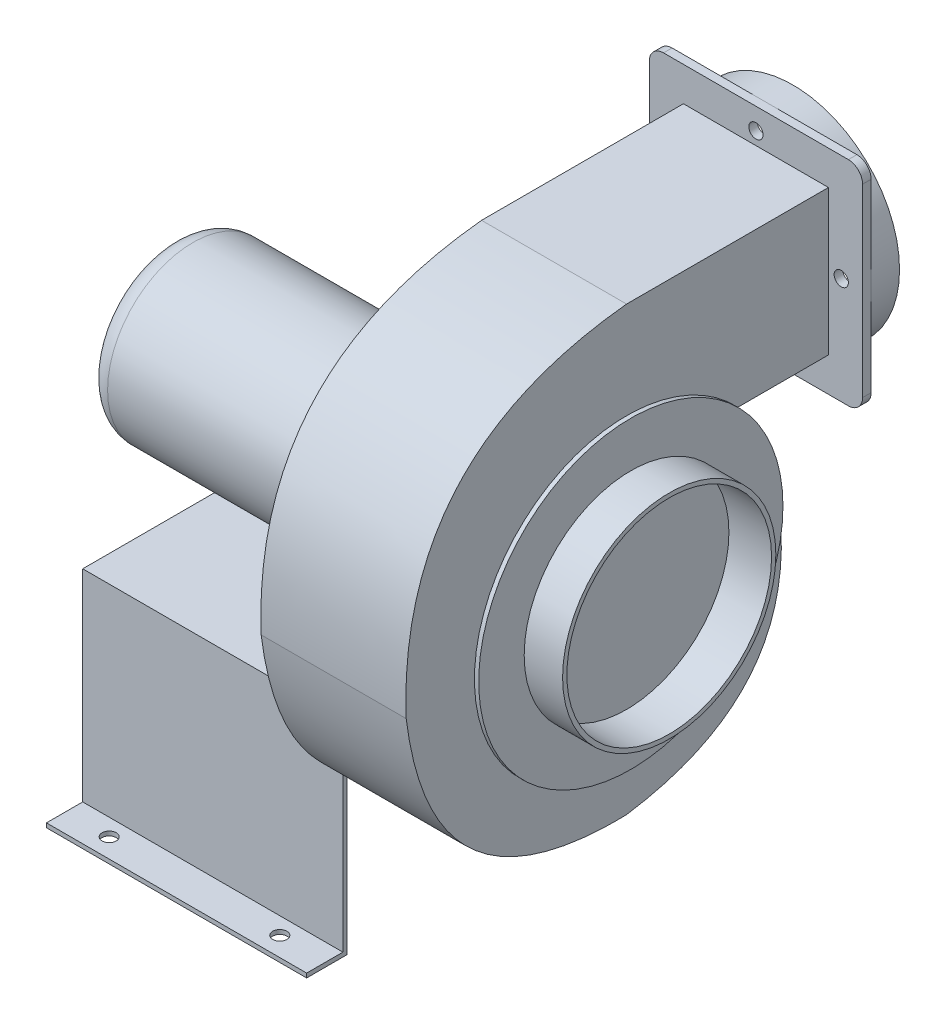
SolidWorks part; units mm, degrees
ref_plane "前视基准面" through (0, 0, 0) normal (0, 0, 1) x (1, 0, 0)
ref_plane "上视基准面" through (0, 0, 0) normal (0, 1, 0) x (1, 0, 0)
ref_plane "右视基准面" through (0, 0, 0) normal (1, 0, 0) x (0, 0, -1)
sketch "草图1" plane through (0, 0, 0) normal (1, 0, 0) x (0, 0, -1)
  line L0 (0, 175) -> (142, 175)
  line L1 (142, 175) -> (142, 73)
  line L2 (142, 73) -> (78.2304, 73)
  arc A0 (107, 0) -> (78.2304, 73) centre (0, 0) ccw
  spline S0 degree 2 poles (0, 175) (-161.0238, 158.2689) (-155, 0) knots 0 0 0 1 1 1
  spline S1 degree 2 poles (-155, 0) (-137.3902, -139.4274) (0, -136) knots 0 0 0 1 1 1
  spline S2 degree 2 poles (107, 0) (123.1633, -117.6999) (0, -136) knots 0 0 0 1 1 1
extrude "凸台-拉伸1" add sketch "草图1" along normal blind 102
sketch "草图2" plane through (0, 0, -142) normal (0, 0, -1) x (-1, 0, 0)
  line L4 (-116, 49) -> (14, 49)
  line L5 (-126, 59) -> (-126, 189)
  line L6 (-116, 199) -> (14, 199)
  line L7 (24, 59) -> (24, 189)
  line L8 (-126, 49) -> (24, 199) construction
  line L9 (-126, 199) -> (24, 49) construction
  arc A0 (14, 199) -> (24, 189) centre (14, 189) cw
  arc A1 (14, 49) -> (24, 59) centre (14, 59) ccw
  arc A2 (-116, 49) -> (-126, 59) centre (-116, 59) cw
  arc A3 (-126, 189) -> (-116, 199) centre (-116, 189) cw
  point P6 (-51, 124)
  dimension "D1" = 10
extrude "凸台-拉伸2" add sketch "草图2" along normal blind 6
sketch "草图3" plane through (0, 0, -148) normal (0, 0, -1) x (-1, 0, 0)
  circle A0 centre (-51, 124) radius 75
  circle A1 centre (-51, 124) radius 72
extrude "凸台-拉伸3" add sketch "草图3" along normal blind 20
sketch "草图4" plane through (0, 0, -148) normal (0, 0, -1) x (-1, 0, 0)
  line L1 (-101, 74) -> (-1, 74)
  line L2 (-101, 74) -> (-101, 174)
  line L3 (-101, 174) -> (-1, 174)
  line L4 (-1, 74) -> (-1, 174)
  line L5 (-101, 74) -> (-1, 174) construction
  line L6 (-101, 174) -> (-1, 74) construction
  point P0 (-51, 124)
extrude "切除-拉伸1" cut sketch "草图4" against normal blind 130
sketch "草图5" plane through (0, 0, -148) normal (0, 0, -1) x (-1, 0, 0)
  circle A1 centre (-51, 184) radius 5
  circle A2 centre (-111, 124) radius 5
  circle A3 centre (9, 124) radius 5
  circle A4 centre (-51, 64) radius 5
extrude "切除-拉伸2" cut sketch "草图5" against normal blind 6
sketch "草图6" plane through (102, 0, 0) normal (1, 0, 0) x (0, 0, -1)
  circle A0 centre (0, 0) radius 107
  circle A1 centre (0, 0) radius 75
extrude "凸台-拉伸4" add sketch "草图6" along normal blind 3
sketch "草图7" plane through (102, 0, 0) normal (1, 0, 0) x (0, 0, -1)
  circle A0 centre (0, 0) radius 75
  circle A1 centre (0, 0) radius 72
extrude "凸台-拉伸5" add sketch "草图7" along normal blind 30
sketch "草图8" plane through (0, 0, 0) normal (-1, 0, 0) x (0, 0, 1)
  circle A0 centre (0, 0) radius 60
extrude "凸台-拉伸6" add sketch "草图8" along normal blind 218 separate body
fillet "圆角1" radius 15 1 edges at (-218, 0, 60)
sketch "草图10" plane through (0, 0, 0) normal (-1, 0, 0) x (0, 0, 1)
  line L1 (-97.5, -80) -> (-97.5, -222)
  line L2 (-97.5, -80) -> (97.5, -80)
  line L3 (97.5, -80) -> (97.5, -222)
  line L4 (-97.5, -222) -> (-123, -222)
  line L5 (-123, -222) -> (-123, -225)
  line L6 (-123, -225) -> (-94.5, -225)
  line L7 (-94.5, -225) -> (-94.5, -83)
  line L8 (-94.5, -83) -> (94.5, -83)
  line L9 (94.5, -83) -> (94.5, -225)
  line L10 (94.5, -225) -> (123, -225)
  line L11 (123, -225) -> (123, -222)
  line L12 (123, -222) -> (97.5, -222)
extrude "凸台-拉伸7" add sketch "草图10" along normal blind 183
sketch "草图11" plane through (0, -225, 0) normal (0, -1, 0) x (1, 0, 0)
  circle A0 centre (-152.4285, 109.4641) radius 5
  circle A1 centre (-32.4285, 109.4641) radius 5
  circle A2 centre (-32.4285, -112.5359) radius 5
  circle A3 centre (-152.4285, -112.5359) radius 5
extrude "切除-拉伸3" cut sketch "草图11" against normal blind 3
